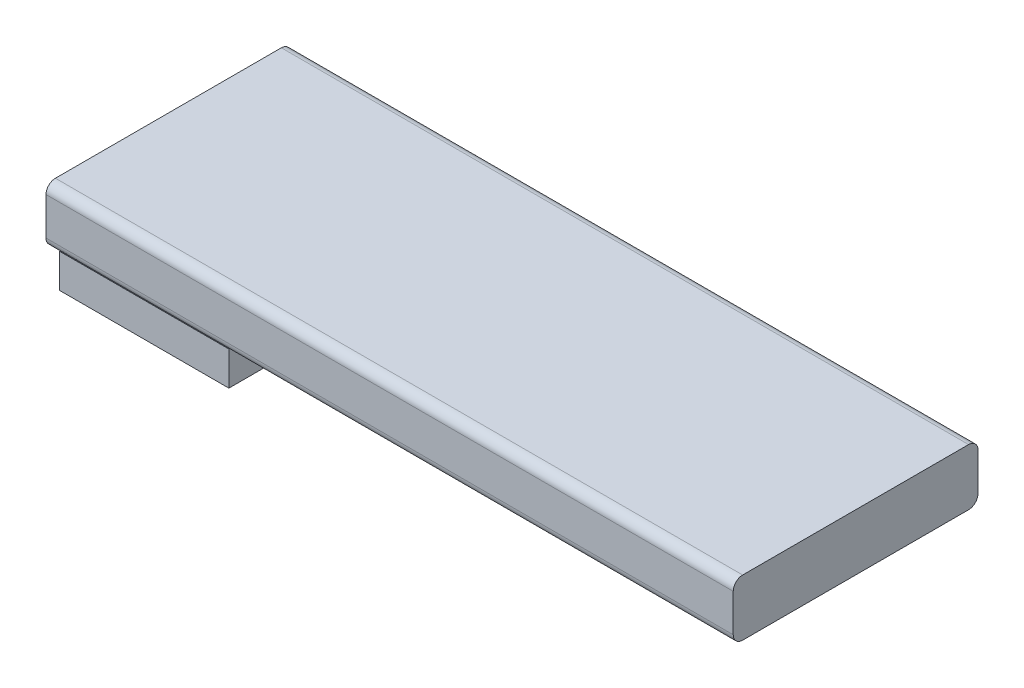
SolidWorks part; units mm, degrees
ref_plane "Front Plane" through (0, 0, 0) normal (0, 0, 1) x (1, 0, 0)
ref_plane "Top Plane" through (0, 0, 0) normal (0, 1, 0) x (1, 0, 0)
ref_plane "Right Plane" through (0, 0, 0) normal (1, 0, 0) x (0, 0, -1)
sketch "Sketch1" plane through (0, 0, 0) normal (1, 0, 0) x (0, 0, -1)
  line L1 (-13, 3) -> (13, 3)
  line L2 (-13, 3) -> (-13, -3)
  line L3 (-13, -3) -> (13, -3)
  line L4 (13, 3) -> (13, -3)
  line L5 (-13, 3) -> (13, -3) construction
  line L6 (-13, -3) -> (13, 3) construction
  point P0 (0, 0)
  dimension "D1" = 26
  dimension "D2" = 6
extrude "Boss-Extrude1" add sketch "Sketch1" along normal blind 73
fillet "Fillet1" radius 1 4 edges at (36.5, -3, -13) (36.5, 3, -13) (36.5, 3, 13) (36.5, -3, 13)
sketch "Sketch2" plane through (0, -3, 0) normal (0, -1, 0) x (1, 0, 0)
  line L1 (0.9272, 12.5) -> (18.9272, 12.5)
  line L2 (0.9272, 12.5) -> (0.9272, -12.5)
  line L3 (0.9272, -12.5) -> (18.9272, -12.5)
  line L4 (18.9272, 12.5) -> (18.9272, -12.5)
  line L5 (0.9272, 12.5) -> (18.9272, -12.5) construction
  line L6 (0.9272, -12.5) -> (18.9272, 12.5) construction
  point P0 (9.9272, 0)
  point P5 (9.9272, 0)
  dimension "D1" = 25
  dimension "D2" = 18
extrude "Boss-Extrude2" add sketch "Sketch2" along normal blind 3.6
sketch "Sketch3" plane through (0, 0, -12.5) normal (0, 0, -1) x (-1, 0, 0)
  line L0 (-0.9272, -3) -> (-18.9272, -3) construction
  line L1 (-13.9272, -3) -> (-5.4272, -3)
  line L2 (-13.9272, -3) -> (-13.9272, -8)
  line L3 (-13.9272, -8) -> (-5.4272, -8)
  line L4 (-5.4272, -3) -> (-5.4272, -8)
  line L5 (-18.9272, -6.6) -> (-18.9272, -3) construction
  dimension "D1" = 5
  dimension "D2" = 8.5
  dimension "D3" = 5
extrude "Boss-Extrude3" add sketch "Sketch3" against normal blind 10
